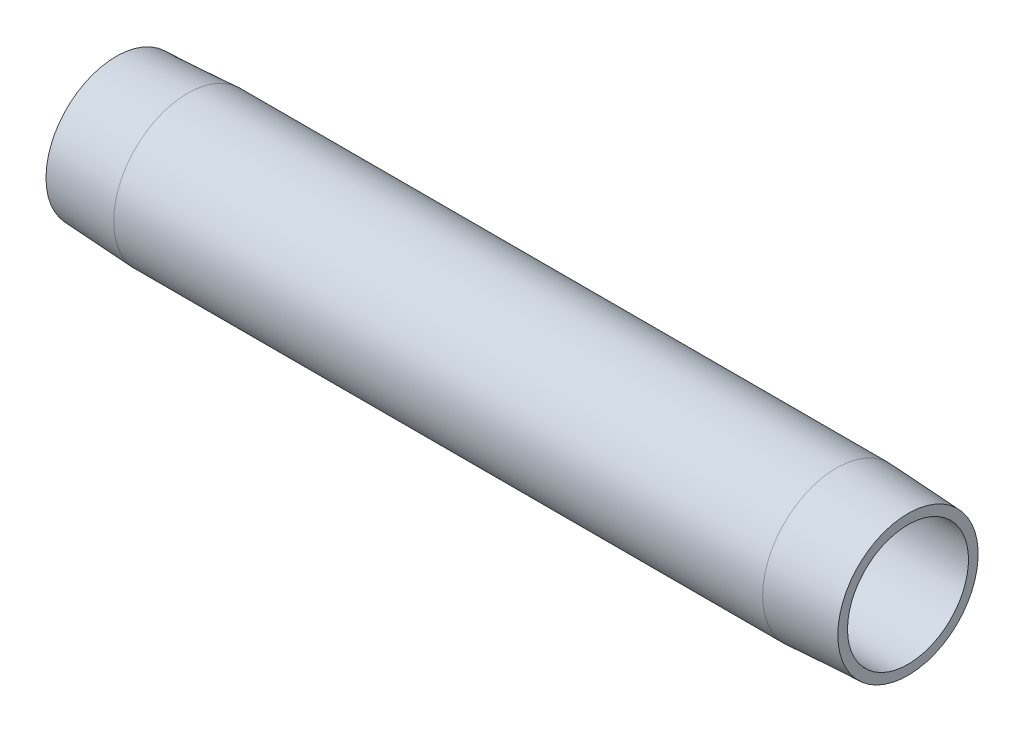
SolidWorks part; units mm, degrees
ref_plane "Front Plane" through (0, 0, 0) normal (0, 0, 1) x (1, 0, 0)
ref_plane "Top Plane" through (0, 0, 0) normal (0, 1, 0) x (1, 0, 0)
ref_plane "Right Plane" through (0, 0, 0) normal (1, 0, 0) x (0, 0, -1)
sketch "Sketch1" plane through (0, 0, 0) normal (0, 0, 1) x (1, 0, 0)
  line L6 (114.3, 8.7313) -> (0, 8.7313)
  line L7 (10.3124, 10.668) -> (0, 10.1276)
  line L8 (103.9876, 10.668) -> (10.3124, 10.668)
  line L9 (114.3, 10.1276) -> (103.9876, 10.668)
  line L10 (114.3, 8.7313) -> (114.3, 10.1276)
  line L11 (0, 10.1276) -> (0, 8.7313)
  line L12 (0, 0) -> (50000, 0) construction
  line L13 (0, -55) -> (0, 55) construction
  dimension "D1" = 114.3
  dimension "D2" = 3
  dimension "D3" = 3
  dimension "D4" = 21.336
  dimension "D5" = 17.4625
  dimension "D6" = 10.3124
  dimension "D7" = 10.3124
revolve "Revolve1" add sketch "Sketch1" angle 360 about L12
